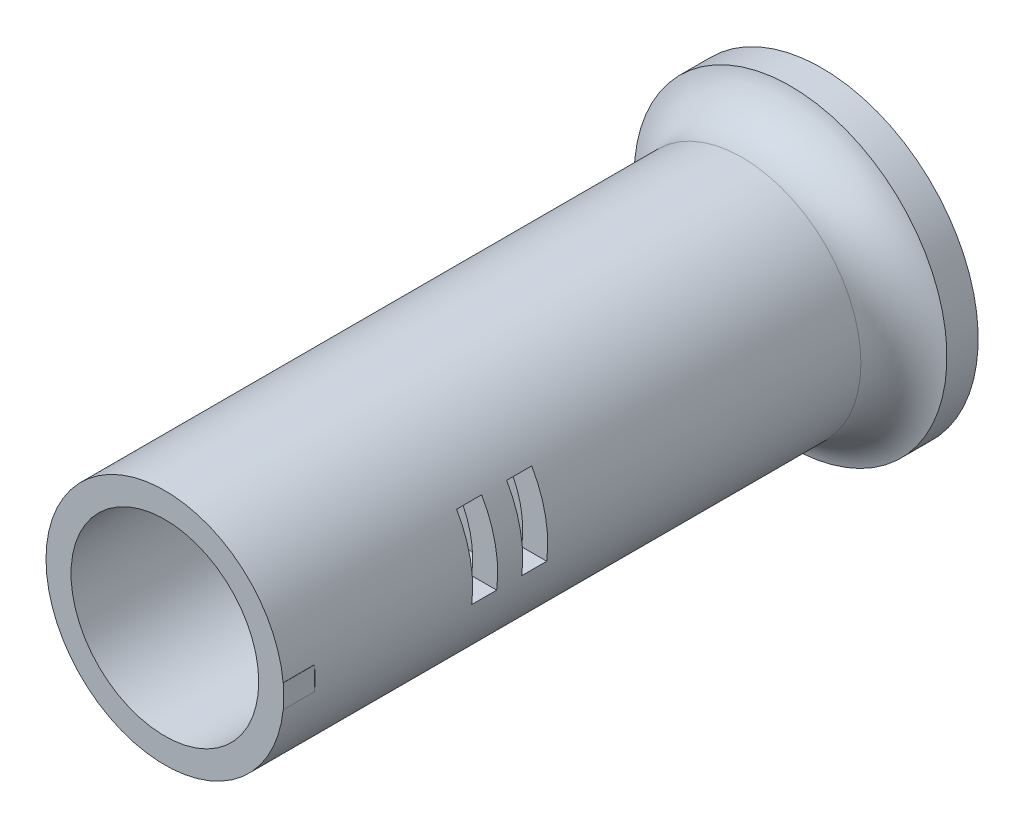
SolidWorks part; units mm, degrees
ref_plane "Front Plane" through (0, 0, 0) normal (0, 0, 1) x (1, 0, 0)
ref_plane "Top Plane" through (0, 0, 0) normal (0, 1, 0) x (1, 0, 0)
ref_plane "Right Plane" through (0, 0, 0) normal (1, 0, 0) x (0, 0, -1)
sketch "Sketch1" plane through (0, 0, 0) normal (0, 0, 1) x (1, 0, 0)
  circle A0 centre (0, 0) radius 24.13
  dimension "D1" = 48.26
extrude "Boss-Extrude1" add sketch "Sketch1" along normal blind 127
sketch "Sketch2" plane through (0, 0, 127) normal (0, 0, 1) x (1, 0, 0)
  circle A0 centre (0, 0) radius 19.05
  dimension "D1" = 38.1
extrude "Cut-Extrude1" cut sketch "Sketch2" against normal blind 63.5
sketch "Sketch3" plane through (0, 0, 0) normal (0, 0, -1) x (-1, 0, 0)
  circle A0 centre (0, 0) radius 31.75
  dimension "D1" = 63.5
extrude "Boss-Extrude2" add sketch "Sketch3" along normal blind 6.35
fillet "Fillet1" radius 10.16 1 edges at (24.13, 0, 0)
sketch "Sketch5" plane through (0, 0, 127) normal (0, 0, 1) x (1, 0, 0)
  line L0 (24.0148, 2.355) -> (24.0148, -2.355)
  line L1 (24.0148, 2.355) -> (26.1521, 2.355)
  line L2 (24.0148, -2.355) -> (26.1521, -2.355)
  line L3 (26.1521, 2.355) -> (26.1521, -2.355)
  circle A0 centre (0, 0) radius 24.13 construction
  circle A1 centre (0, 0) radius 24.13 construction
extrude "Boss-Extrude3" add sketch "Sketch5" against normal blind 6.35
sketch "Sketch6" plane through (26.1521, 0, 0) normal (1, 0, 0) x (0, 0, -1)
  line L1 (-88.648, 12.1086) -> (-83.568, 12.1086)
  line L2 (-88.648, 12.1086) -> (-88.648, -3.1314)
  line L3 (-88.648, -3.1314) -> (-83.568, -3.1314)
  line L4 (-83.568, 12.1086) -> (-83.568, -3.1314)
  line L5 (-78.488, 12.1086) -> (-73.408, 12.1086)
  line L6 (-78.488, 12.1086) -> (-78.488, -3.1314)
  line L7 (-78.488, -3.1314) -> (-73.408, -3.1314)
  line L8 (-73.408, 12.1086) -> (-73.408, -3.1314)
  dimension "D1" = 15.24
  dimension "D2" = 15.24
  dimension "D3" = 5.08
  dimension "D4" = 5.08
  dimension "D5" = 15.24
extrude "Cut-Extrude2" cut sketch "Sketch6" against normal blind 17.526
sketch "Sketch7" plane through (26.1521, 0, 0) normal (1, 0, 0) x (0, 0, -1)
  line L1 (-120.65, 2.355) -> (-127, 2.355)
  line L2 (-120.65, 2.355) -> (-120.65, -2.355)
  line L3 (-120.65, -2.355) -> (-127, -2.355)
  line L4 (-127, 2.355) -> (-127, -2.355)
extrude "Cut-Extrude3" cut sketch "Sketch7" against normal blind 2.0955
